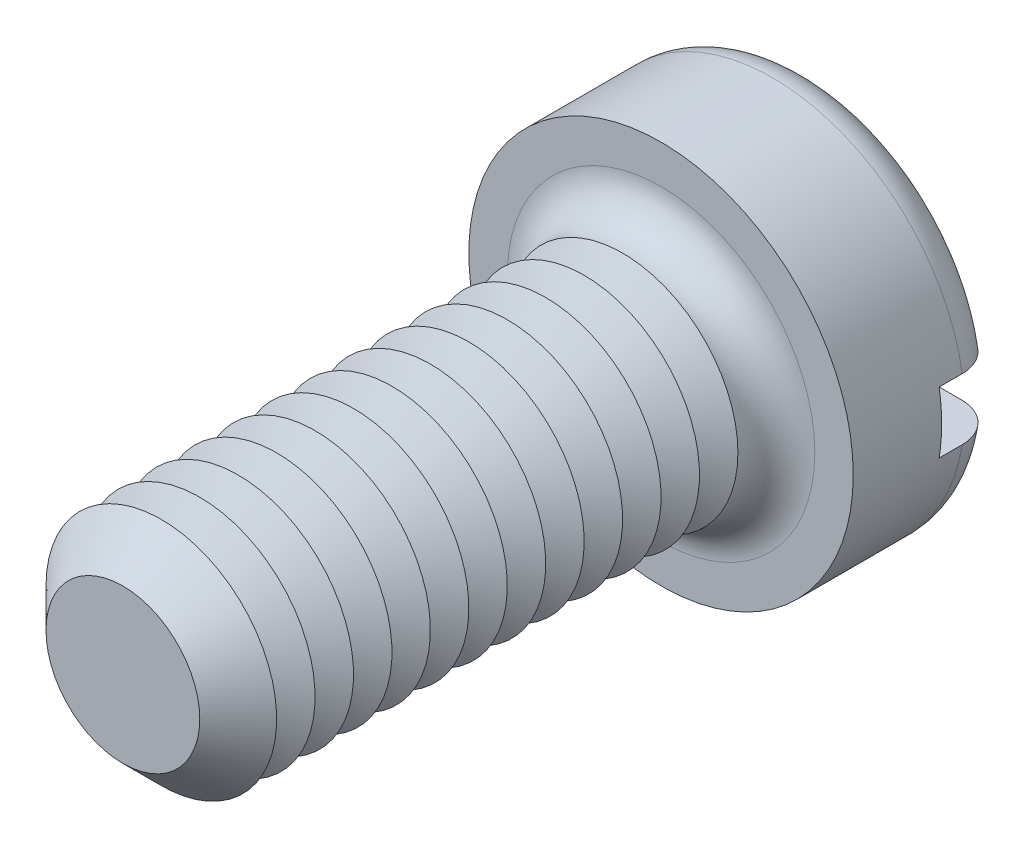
SolidWorks part; units mm, degrees
ref_plane "Front Plane" through (0, 0, 0) normal (0, 0, 1) x (1, 0, 0)
ref_plane "Top Plane" through (0, 0, 0) normal (0, 1, 0) x (1, 0, 0)
ref_plane "Right Plane" through (0, 0, 0) normal (1, 0, 0) x (0, 0, -1)
sketch "Sketch3" plane through (0, 0, 0) normal (0, 0, 1) x (1, 0, 0)
  circle A0 centre (0, 0) radius 5
  dimension "D1" = 10
extrude "Boss-Extrude2" add sketch "Sketch3" against normal blind 3.9
sketch "Sketch4" plane through (0, 0, 0) normal (0, 0, 1) x (1, 0, 0)
  circle A0 centre (0, 0) radius 3
  dimension "D1" = 6
extrude "Boss-Extrude3" add sketch "Sketch4" along normal blind 14
fillet "Fillet1" radius 1 2 edges at (5, 0, -3.9) (3, 0, 0)
chamfer "Chamfer1" distance 1 angle 45 1 edges at (3, 0, 14)
sketch "Sketch5" plane through (0, 0, 0) normal (1, 0, 0) x (0, 0, -1)
  line L0 (1.6944, 0) -> (-7.6738, 0) construction
sketch "Sketch6" plane through (0, 0, 0) normal (1, 0, 0) x (0, 0, -1)
  line L0 (-1, 3) -> (-1.5, 2.134)
  line L1 (-1.5, 2.134) -> (-2, 3)
  line L2 (-1, 3) -> (-13, 3) construction
  line L3 (-2, 3) -> (-1, 3)
  dimension "D1" = 1
revolve "Cut-Revolve1" cut sketch "Sketch6" angle 360 about L0
pattern_linear "LPattern1" count 12 spacing 1 along (0, 0, 1) of "Cut-Revolve1"
sketch "Sketch8" plane through (0, 0, -3.9) normal (0, 0, -1) x (-1, 0, 0)
  line L1 (5, -0.8) -> (-5, -0.8)
  line L2 (5, -0.8) -> (5, 0.8)
  line L3 (5, 0.8) -> (-5, 0.8)
  line L4 (-5, -0.8) -> (-5, 0.8)
  line L5 (5, -0.8) -> (-5, 0.8) construction
  line L6 (5, 0.8) -> (-5, -0.8) construction
  point P0 (0, 0)
  dimension "D1" = 10
  dimension "D2" = 1.6
extrude "Cut-Extrude1" cut sketch "Sketch8" against normal blind 1.6
